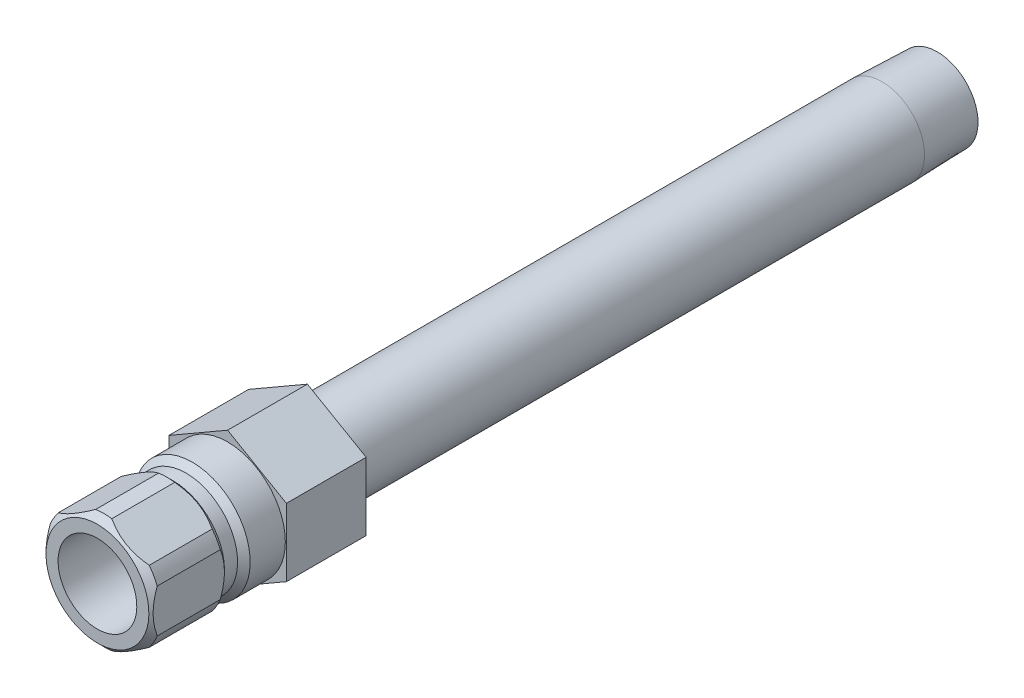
SolidWorks part; units mm, degrees
ref_plane "Front Plane" through (0, 0, 0) normal (0, 0, 1) x (1, 0, 0)
ref_plane "Top Plane" through (0, 0, 0) normal (0, 1, 0) x (1, 0, 0)
ref_plane "Right Plane" through (0, 0, 0) normal (1, 0, 0) x (0, 0, -1)
sketch "Sketch1" plane through (0, 0, 0) normal (1, 0, 0) x (0, 0, -1)
  line L0 (9.652, 0) -> (-18.923, 0) construction
  line L1 (-15.748, 4.7625) -> (-15.748, 6.223)
  line L2 (-6.604, 6.223) -> (-6.604, 0) construction
  line L3 (-14.986, 6.985) -> (-7.366, 6.985)
  line L4 (9.652, 5.1435) -> (9.652, 0) construction
  line L5 (-6.604, 6.223) -> (-5.0165, 6.223)
  line L6 (-4.2545, 6.985) -> (9.652, 6.985)
  line L7 (9.652, 6.985) -> (9.652, 5.1435)
  line L8 (-6.604, 6.223) -> (-7.366, 6.985)
  line L9 (-5.0165, 6.223) -> (-4.2545, 6.985)
  line L10 (-15.748, 6.223) -> (-14.986, 6.985)
  line L11 (-15.748, 4.7625) -> (-3.556, 4.7625)
  line L12 (9.652, 5.1435) -> (79.1718, 5.1435)
  line L13 (79.1718, 5.1435) -> (85.852, 4.9347)
  line L14 (85.852, 4.9347) -> (85.852, 3.4163)
  line L15 (-3.556, 4.7625) -> (-3.556, 6.985) construction
  line L16 (9.652, 6.731) -> (9.652, 0) construction
  line L17 (-3.556, 4.7625) -> (-2.8402, 3.4163)
  line L19 (-2.8402, 3.4163) -> (85.852, 3.4163)
  dimension "D2" = 1.5875
  dimension "D3" = 0.762
  dimension "D4" = 45
  dimension "D5" = 9.144
  dimension "D6" = 45
  dimension "D7" = 1.79
  dimension "D8" = 6.6802
  dimension "D9" = 101.6
  dimension "D10" = 3.175
  dimension "D11" = 9.525
  dimension "D12" = 10.287
  dimension "D13" = 25.4
  dimension "D14" = 13.97
  dimension "D15" = 6.8326
  dimension "D16" = 15.748
  dimension "D17" = 12.192
  dimension "D18" = 118
revolve "Revolve1" add sketch "Sketch1" angle 360 about L0
sketch "Sketch2" plane through (0, 0, 0) normal (0, 0, 1) x (1, 0, 0)
  line L1 (-7.112, 4.1061) -> (-7.112, -4.1061)
  line L2 (-7.112, -4.1061) -> (0, -8.2122)
  line L3 (0, -8.2122) -> (7.112, -4.1061)
  line L4 (7.112, -4.1061) -> (7.112, 4.1061)
  line L5 (7.112, 4.1061) -> (0, 8.2122)
  line L6 (0, 8.2122) -> (-7.112, 4.1061)
  circle A0 centre (0, 0) radius 7.112 construction
  circle A1 centre (0, 0) radius 4.7625 construction
  circle A2 centre (0, 0) radius 4.7625
  dimension "D1" = 14.224
extrude "Boss-Extrude1" add sketch "Sketch2" against normal up to vertex (9.652 mm away)
sketch "Sketch3" plane through (0, 0, 0) normal (0, 0, 1) x (1, 0, 0)
  line L1 (6.477, 3.7395) -> (0, 7.479)
  line L2 (0, 7.479) -> (-6.477, 3.7395)
  line L3 (-6.477, 3.7395) -> (-6.477, -3.7395)
  line L4 (-6.477, -3.7395) -> (0, -7.479)
  line L5 (0, -7.479) -> (6.477, -3.7395)
  line L6 (6.477, -3.7395) -> (6.477, 3.7395)
  circle A0 centre (0, 0) radius 6.477 construction
  dimension "D1" = 12.954
extrude "Cut-Extrude1" cut sketch "Sketch3" along normal through all from vertex at 6.604 flip side to cut
